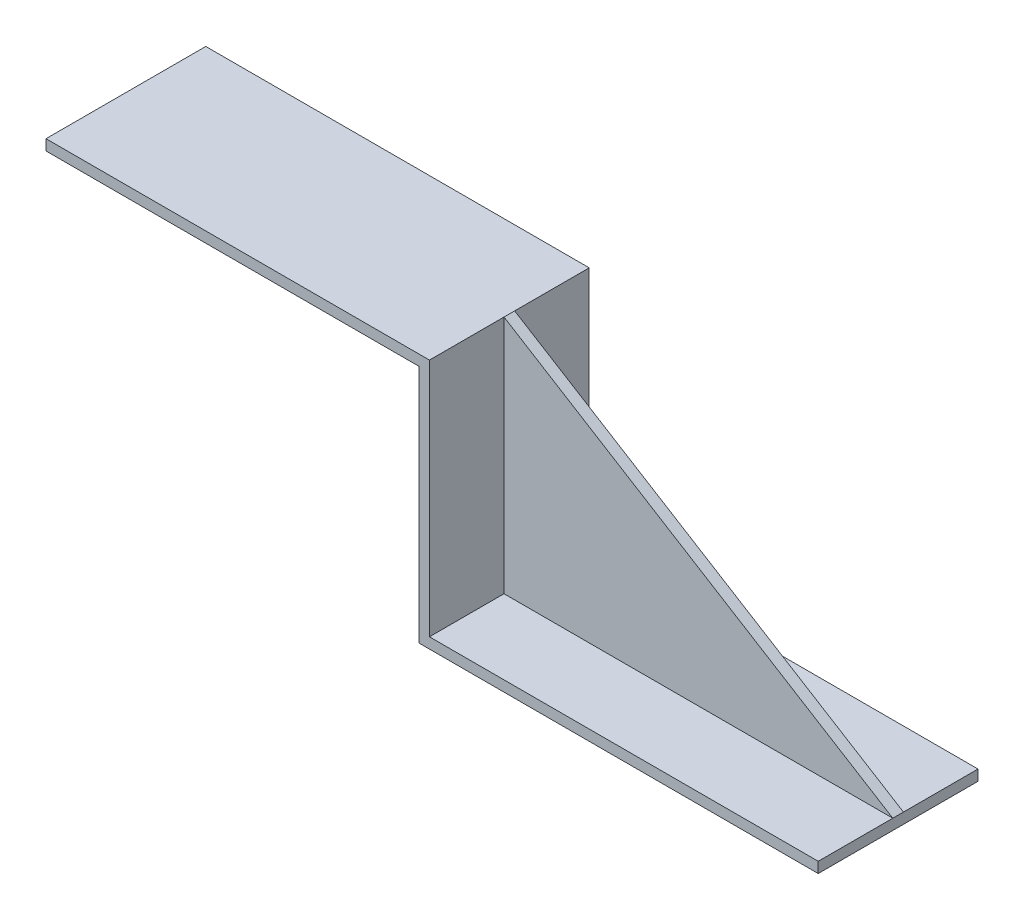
SolidWorks part; units mm, degrees
ref_plane "Front Plane" through (0, 0, 0) normal (0, 0, 1) x (1, 0, 0)
ref_plane "Top Plane" through (0, 0, 0) normal (0, 1, 0) x (1, 0, 0)
ref_plane "Right Plane" through (0, 0, 0) normal (1, 0, 0) x (0, 0, -1)
sketch "Sketch1" plane through (0, 0, 0) normal (0, 0, 1) x (1, 0, 0)
  line L0 (0, 0) -> (-75, 0)
  line L1 (-75, 0) -> (-75, 45)
  line L2 (-75, 45) -> (-145, 45)
  dimension "D1" = 75
  dimension "D2" = 70
  dimension "D3" = 45
extrude "Extrude-Thin1" add sketch "Sketch1" along normal mid plane 30 thin
sketch "Sketch2" plane through (0, 0, 0) normal (0, 0, 1) x (1, 0, 0)
  line L0 (-73, 47) -> (0, 2)
rib "Rib1" sketch "Sketch2" sketch "Sketch2" thickness 2 extrusion direction parallel to sketch draft on no parameters "D1"=2, "Thickness"=2
